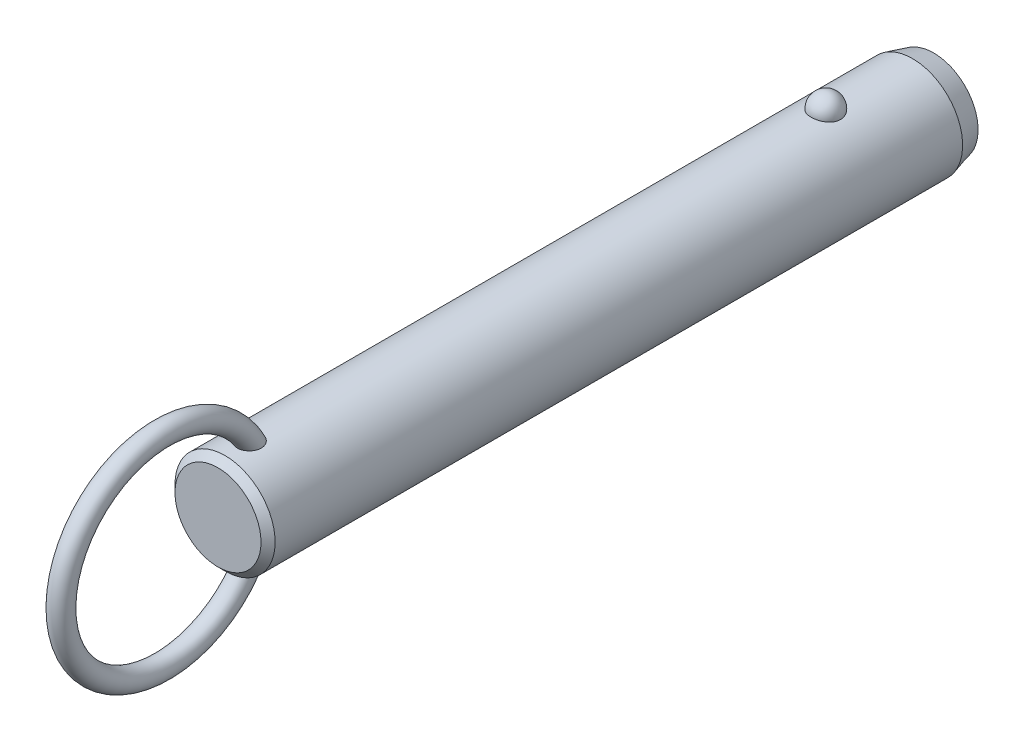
SolidWorks part; units mm, degrees
ref_plane "Front Plane" through (0, 0, 0) normal (0, 0, 1) x (1, 0, 0)
ref_plane "Top Plane" through (0, 0, 0) normal (0, 1, 0) x (1, 0, 0)
ref_plane "Right Plane" through (0, 0, 0) normal (1, 0, 0) x (0, 0, -1)
sketch "Sketch2" plane through (0, 0, 0) normal (0, 0, 1) x (1, 0, 0)
  circle A0 centre (0, 0) radius 7.1
  point P3 (0, 7.1)
  dimension "D1" = 14.2
extrude "Boss-Extrude1" add sketch "Sketch2" along normal blind 76.2
sketch "Sketch3" plane through (0, 0, 0) normal (0, 0, -1) x (-1, 0, 0)
  circle A0 centre (0, 0) radius 7.1
  dimension "D1" = 14.2
extrude "Boss-Extrude2" add sketch "Sketch3" along normal blind 17.4
chamfer "Chamfer1" distance 3 angle 15 1 edges at (-7.1, 0, -17.4)
sketch "Sketch12" plane through (0, 0, 0) normal (1, 0, 0) x (0, 0, -1)
  line L0 (-76.2, 7.1) -> (-76.2, -7.1) construction
  point P0 (-76.2, 0)
sketch "Sketch13" plane through (0, 0, 0) normal (1, 0, 0) x (0, 0, -1)
  circle A0 centre (-92.05, 0) radius 15.85
  point P2 (-76.2, 0)
  dimension "D1" = 31.7
sketch "Sketch14" plane through (0, 0, 0) normal (0, 1, 0) x (1, 0, 0)
  circle A0 centre (0, -77.7) radius 1.5
  point P2 (0, -76.2)
  dimension "D1" = 3
sweep "Sweep1" add profiles "Sketch14" path "Sketch13"
sketch "Sketch15" plane through (0, 0, 76.2) normal (0, 0, 1) x (1, 0, 0)
  circle A0 centre (0, 0) radius 7.1
  dimension "D1" = 14.2
extrude "Boss-Extrude3" add sketch "Sketch15" along normal blind 7.92
chamfer "Chamfer2" distance 1 angle 45 1 edges at (7.1, 0, 84.12)
sketch "Sketch18" plane through (0, 0, 0) normal (1, 0, 0) x (0, 0, -1)
  line L0 (14.4, 7.1) -> (-77.8792, 7.1) construction
  line L1 (2.1, 9.2) -> (2.1, 5)
  line L2 (-77.8792, -7.1) -> (14.4, -7.1) construction
  arc A0 (2.1, 9.2) -> (2.1, 5) centre (2.1, 7.1) ccw
  point P4 (0, 7.1)
  dimension "D1" = 16.3
revolve "Revolve1" add sketch "Sketch18" angle 360 about L1
